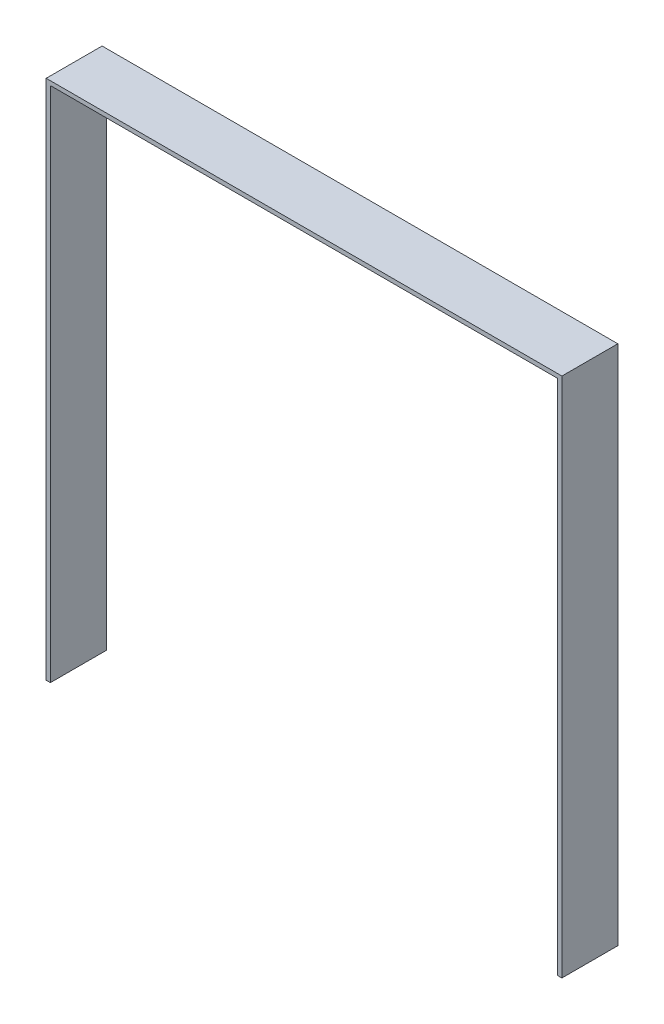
SolidWorks part; units mm, degrees
ref_plane "Front Plane" through (0, 0, 0) normal (0, 0, 1) x (1, 0, 0)
ref_plane "Top Plane" through (0, 0, 0) normal (0, 1, 0) x (1, 0, 0)
ref_plane "Right Plane" through (0, 0, 0) normal (1, 0, 0) x (0, 0, -1)
sketch "Sketch1" plane through (0, 0, 0) normal (0, 0, 1) x (1, 0, 0)
  line L0 (-184.5, 186.5) -> (184.5, 186.5)
  line L1 (-184.5, -186.5) -> (-184.5, 186.5)
  line L2 (184.5, -186.5) -> (184.5, 186.5)
  line L3 (-181.5, -186.5) -> (-181.5, 183.5)
  line L4 (-181.5, 183.5) -> (181.5, 183.5)
  line L5 (181.5, -186.5) -> (181.5, 183.5)
  line L6 (-184.5, -186.5) -> (-181.5, -186.5)
  line L7 (181.5, -186.5) -> (184.5, -186.5)
  line L8 (-184.5, 0) -> (184.5, 0) construction
  line L9 (0, -110.3048) -> (0, 186.5) construction
  point P3 (0, 186.5)
  point P6 (-184.5, 0)
  point P8 (184.5, 0)
  dimension "D2" = 363
  dimension "D3" = 370
  dimension "D1" = 3
extrude "Boss-Extrude1" add sketch "Sketch1" along normal mid plane 40
